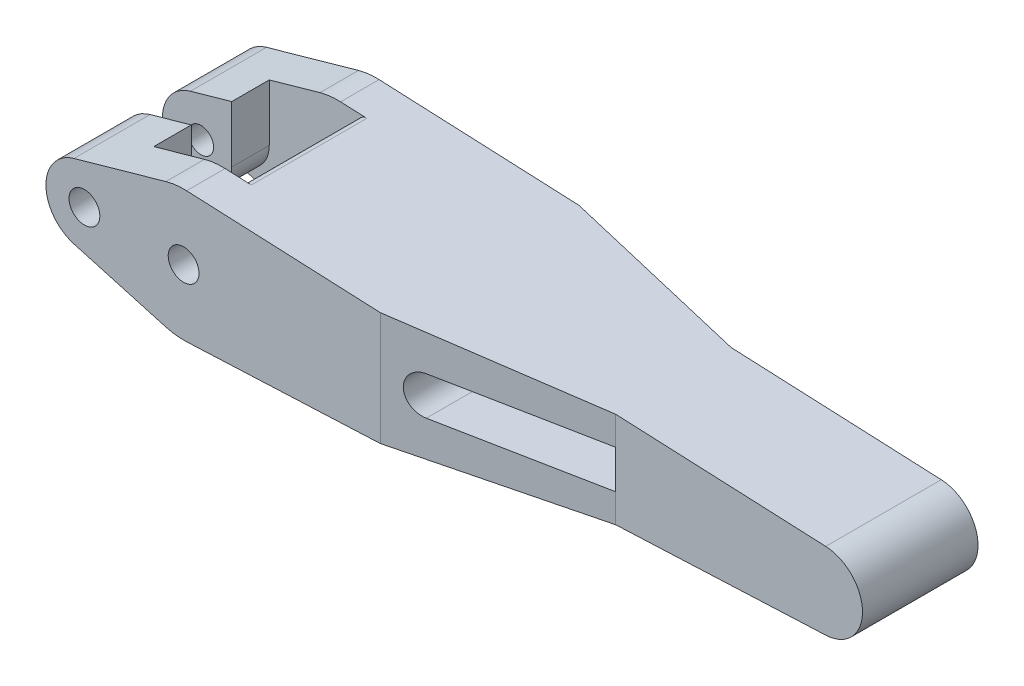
SolidWorks part; units mm, degrees
ref_plane "Front Plane" through (0, 0, 0) normal (0, 0, 1) x (1, 0, 0)
ref_plane "Top Plane" through (0, 0, 0) normal (0, 1, 0) x (1, 0, 0)
ref_plane "Right Plane" through (0, 0, 0) normal (1, 0, 0) x (0, 0, -1)
imported_body "Imported3"
sketch "Sketch1" plane through (0, 0, 20) normal (0, 0, -1) x (-1, 0, 0)
  line L0 (14.2359, -4.8118) -> (13.9641, -4.8885)
  line L1 (8.8769, -1.0391) -> (8.8769, 6.3237)
  line L2 (8.8769, 6.3237) -> (14.2359, 4.8118)
  arc A0 (14.2359, 4.8118) -> (14.2359, -4.8118) centre (12.8769, 0) cw
  arc A1 (13.9641, -4.8885) -> (8.8769, -1.0391) centre (12.8769, -1.0391) cw
extrude "Boss-Extrude1" add sketch "Sketch1" along normal blind 4.875
sketch "Sketch2" plane through (0, 0, 5) normal (0, 0, 1) x (1, 0, 0)
  line L0 (-14.2359, 4.8118) -> (-8.8769, 6.3237)
  line L1 (-8.8769, 6.3237) -> (-8.8769, -1.0391)
  line L2 (-13.9641, -4.8885) -> (-14.2359, -4.8118)
  arc A0 (-8.8769, -1.0391) -> (-13.9641, -4.8885) centre (-12.8769, -1.0391) cw
  arc A1 (-14.2359, -4.8118) -> (-14.2359, 4.8118) centre (-12.8769, 0) cw
extrude "Boss-Extrude2" add sketch "Sketch2" along normal blind 4.875
ref_plane "Plane1" through (5.6491, 0, 28.8895) normal (0.1919, 0, 0.9814) x (0, 1, 0)
ref_plane "Plane2" through (0, 0, 15) normal (0, 0, -1) x (-1, 0, 0)
sketch "Sketch4" plane through (0, 0, 15) normal (0, 0, -1) x (-1, 0, 0)
  line L0 (-73.1564, -2.5) -> (-30.5398, -2.5)
  line L1 (-30.5398, 2.5) -> (-73.1564, 2.5)
  arc A0 (-73.1564, 2.5) -> (-73.1564, -2.5) centre (-73.1564, 0) ccw
  arc A1 (-30.5398, -2.5) -> (-30.5398, 2.5) centre (-30.5398, 0) ccw
extrude "Cut-Extrude1" cut sketch "Sketch4" against normal up to surface
ref_plane "Plane3" through (0, 0, 5) normal (0, 0, -1) x (-1, 0, 0)
ref_plane "Plane4" through (0, 0, 10) normal (0, 0, 1) x (1, 0, 0)
sketch "Sketch6" plane through (0, 0, 10) normal (0, 0, 1) x (1, 0, 0)
  line L0 (31.3321, -2.5) -> (73.1564, -2.5)
  line L1 (73.1564, 2.5) -> (31.3321, 2.5)
  arc A0 (31.3321, 2.5) -> (31.3321, -2.5) centre (31.3321, 0) ccw
  arc A1 (73.1564, -2.5) -> (73.1564, 2.5) centre (73.1564, 0) ccw
extrude "Cut-Extrude2" cut sketch "Sketch6" against normal up to surface
hole_wizard "Ø3.3 (3.3) Diameter Hole1" positions "Sketch8" profile "Sketch7" hole size "Ø3.3" standard "Ansi Metric"
sketch "Sketch8" plane through (0, 0, 5) normal (0, 0, 1) x (1, 0, 0)
  point P0 (0, 0)
sketch "Sketch7" plane through (0, 0, 5) normal (1, 0, 0) x (0, -1, 0)
  line L0 (0, 0) -> (0, 5.0001)
  line L1 (0, 5.0001) -> (1.65, 5.0001)
  line L2 (1.65, 5.0001) -> (1.65, 0)
  line L5 (1.65, 0) -> (0, 0)
  line L11 (0, -6.35) -> (0, 107.95) construction
  dimension "Thru Hole Dia." = 3.3
  dimension "Thru Hole Depth" = 5.0001
hole_wizard "Ø3.3 (3.3) Diameter Hole2" positions "Sketch10" profile "Sketch9" hole size "Ø3.3" standard "Ansi Metric"
sketch "Sketch10" plane through (0, 0, 0) normal (0, 0, -1) x (-1, 0, 0)
  point P0 (12.8769, 0)
sketch "Sketch9" plane through (-12.8769, 0, 0) normal (1, 0, 0) x (0, 1, 0)
  line L0 (0, 0) -> (0, 9.875)
  line L1 (0, 9.875) -> (1.65, 9.875)
  line L2 (1.65, 9.875) -> (1.65, 0)
  line L5 (1.65, 0) -> (0, 0)
  line L11 (0, -6.35) -> (0, 107.95) construction
  dimension "Thru Hole Dia." = 3.3
  dimension "Thru Hole Depth" = 9.875
hole_wizard "Ø4.0 (4) Diameter Hole1" positions "Sketch12" profile "Sketch11" hole size "Ø4.0" standard "Ansi Metric"
sketch "Sketch12" plane through (0, 0, 15.125) normal (0, 0, -1) x (-1, 0, 0)
  point P0 (12.8769, 0)
sketch "Sketch11" plane through (-12.8769, 0, 15.125) normal (1, 0, 0) x (0, 1, 0)
  line L0 (0, 0) -> (0, 9.8751)
  line L1 (0, 9.8751) -> (2, 9.8751)
  line L2 (2, 9.8751) -> (2, 0)
  line L5 (2, 0) -> (0, 0)
  line L11 (0, -6.35) -> (0, 107.95) construction
  dimension "Thru Hole Dia." = 4
  dimension "Thru Hole Depth" = 9.8751
hole_wizard "Ø4.0 (4) Diameter Hole2" positions "Sketch14" profile "Sketch13" hole size "Ø4.0" standard "Ansi Metric"
sketch "Sketch14" plane through (0, 0, 20) normal (0, 0, -1) x (-1, 0, 0)
  point P0 (0, 0)
sketch "Sketch13" plane through (0, 0, 20) normal (1, 0, 0) x (0, 1, 0)
  line L0 (0, 0) -> (0, 5.0001)
  line L1 (0, 5.0001) -> (2, 5.0001)
  line L2 (2, 5.0001) -> (2, 0)
  line L5 (2, 0) -> (0, 0)
  line L11 (0, -6.35) -> (0, 107.95) construction
  dimension "Thru Hole Dia." = 4
  dimension "Thru Hole Depth" = 5.0001
fillet "Fillet1" radius 1 1 edges at (23, -7.4757, 12.5)
fillet "Fillet2" radius 8.5 4 edges at (-0.9772, 8.5523, 2.5) (-0.9772, 8.5523, 22.5) (-0.9896, -8.553, 22.5) (-0.9896, -8.553, 2.5)
